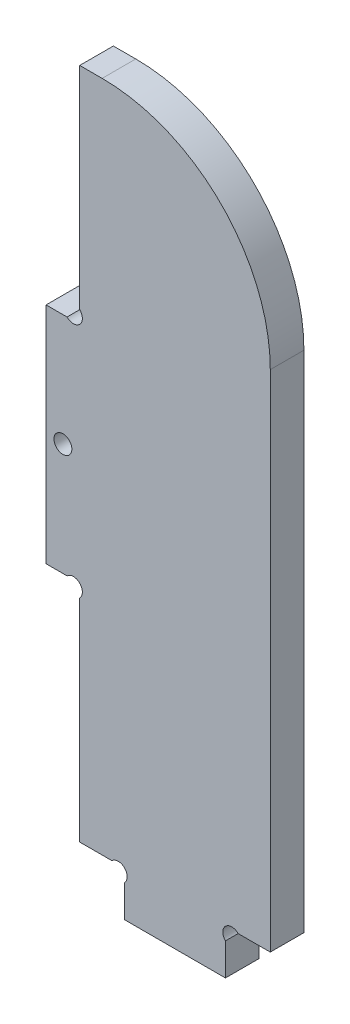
SolidWorks part; units mm, degrees
ref_plane "Face" through (0, 0, 0) normal (0, 0, 1) x (1, 0, 0)
ref_plane "Dessus" through (0, 0, 0) normal (0, 1, 0) x (1, 0, 0)
ref_plane "Droite" through (0, 0, 0) normal (1, 0, 0) x (0, 0, -1)
sketch "Esquisse1" plane through (0, 0, 0) normal (0, 0, 1) x (1, 0, 0)
  line L0 (0, -15.4544) -> (0, 152.5539) construction
  line L2 (0, 90) -> (0, 50)
  line L3 (6, 130) -> (10, 130)
  line L4 (40, 10) -> (40, 100)
  line L5 (20, -15.4544) -> (20, 152.5539) construction
  line L6 (-17.9999, 0) -> (64.1563, 0) construction
  line L7 (-17.9999, 70) -> (64.1563, 70) construction
  line L8 (-17.9999, 10) -> (64.1563, 10) construction
  line L9 (6, 90) -> (-5.6548, 101.6548) construction
  line L10 (6, 92.2627) -> (6, 130)
  line L11 (3.7373, 90) -> (0, 90)
  line L12 (6, 47.7373) -> (6, 10)
  line L13 (14, -15.4544) -> (14, 16.43) construction
  line L14 (14, 10) -> (2.8166, -1.1834) construction
  line L15 (14, 7.7373) -> (14, 2)
  line L16 (11.7373, 10) -> (6, 10)
  line L17 (23, 3.923) -> (23, -15.4544) construction
  line L18 (11.3726, 2) -> (38.276, 2) construction
  line L19 (6, 136.274) -> (6, 65.5769) construction
  line L20 (3, 118.5104) -> (3, 65.5769) construction
  line L21 (-13.5698, 90) -> (8.8686, 90) construction
  line L22 (3.7373, 50) -> (0, 50)
  line L23 (-13.5698, 110) -> (7.7373, 110) construction
  line L24 (40, 6.4809) -> (40, -12.7036) construction
  line L25 (32, 7.7373) -> (32, 2)
  line L26 (34.2627, 10) -> (40, 10)
  line L27 (14, 2) -> (32, 2)
  arc A0 (14, 7.7373) -> (11.7373, 10) centre (12.8686, 8.8686) ccw
  arc A1 (32, 7.7373) -> (34.2627, 10) centre (33.1314, 8.8686) cw
  circle A2 centre (3, 70) radius 1.6
  arc A3 (3.7373, 90) -> (6, 92.2627) centre (4.8686, 91.1314) ccw
  arc A4 (3.7373, 50) -> (6, 47.7373) centre (4.8686, 48.8686) cw
  arc A5 (10, 130) -> (40, 100) centre (10, 100) cw
  dimension "D7" = 20
  dimension "D8" = 14
  dimension "D9" = 45
  dimension "D10" = 6
  dimension "D4" = 17
  dimension "D5" = 30
  dimension "D1" = 10
  dimension "D2" = 60
  dimension "D3" = 45
  dimension "D6" = 8
  dimension "D11" = 3
  dimension "D12" = 20
  dimension "D14" = 20
extrude "Extrusion1" add sketch "Esquisse1" along normal blind 6
